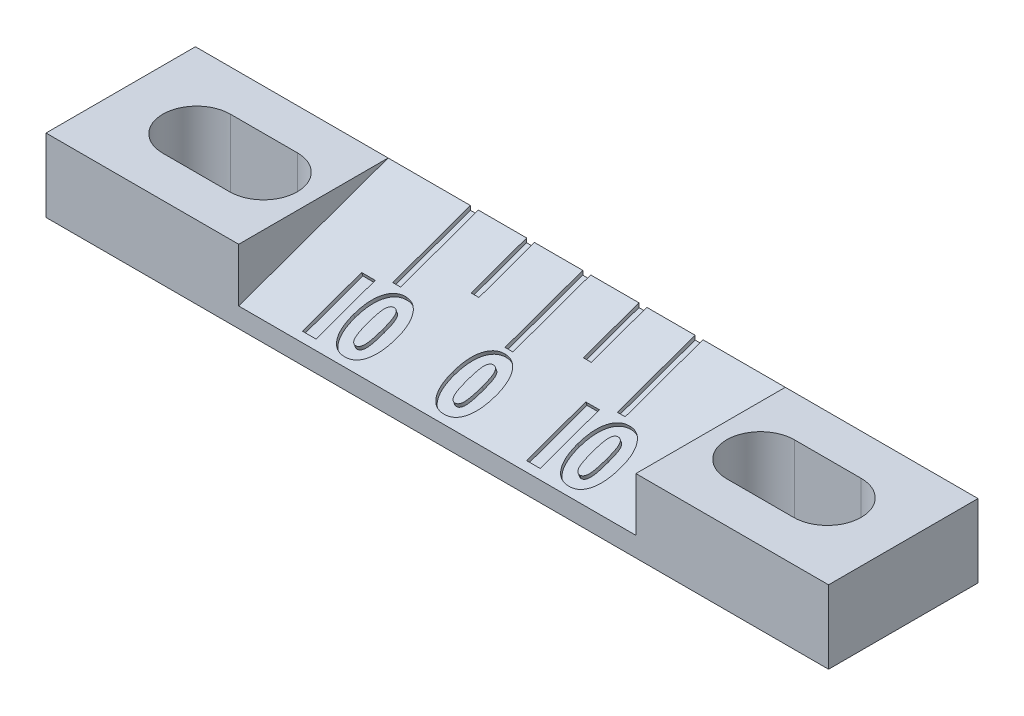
SolidWorks part; units mm, degrees
ref_plane "Спереди" through (0, 0, 0) normal (0, 0, 1) x (1, 0, 0)
ref_plane "Сверху" through (0, 0, 0) normal (0, 1, 0) x (1, 0, 0)
ref_plane "Справа" through (0, 0, 0) normal (1, 0, 0) x (0, 0, -1)
sketch "Эскиз1" plane through (0, 0, 0) normal (0, 1, 0) x (1, 0, 0)
  line L0 (2.4511, 0) -> (4.6101, 0) construction
  line L1 (0, 2.413) -> (25.273, 2.413)
  line L2 (0, 2.413) -> (0, -2.413)
  line L3 (0, -2.413) -> (25.273, -2.413)
  line L4 (25.273, 2.413) -> (25.273, -2.413)
  line L5 (2.4511, 1.0922) -> (4.6101, 1.0922)
  line L6 (2.4511, -1.0922) -> (4.6101, -1.0922)
  line L7 (20.6629, 0) -> (22.8219, 0) construction
  line L8 (20.6629, 1.0922) -> (22.8219, 1.0922)
  line L9 (20.6629, -1.0922) -> (22.8219, -1.0922)
  line L10 (12.6365, -4.7058) -> (12.6365, 8.8435) construction
  arc A0 (2.4511, 1.0922) -> (2.4511, -1.0922) centre (2.4511, 0) ccw
  arc A1 (4.6101, -1.0922) -> (4.6101, 1.0922) centre (4.6101, 0) ccw
  arc A2 (20.6629, 1.0922) -> (20.6629, -1.0922) centre (20.6629, 0) ccw
  arc A3 (22.8219, -1.0922) -> (22.8219, 1.0922) centre (22.8219, 0) ccw
  point P7 (3.5306, 0)
  point P12 (21.7424, 0)
  dimension "D1" = 25.273
  dimension "D2" = 2.413
  dimension "D3" = 2.1844
  dimension "D4" = 2.159
  dimension "D5" = 20.3708
  dimension "D6" = 10.1854
extrude "Бобышка-Вытянуть1" add sketch "Эскиз1" along normal blind 2.3622
sketch "Эскиз2" plane through (0, 0, 0) normal (-1, 0, 0) x (0, 0, 1)
  line L0 (-2.413, 2.3622) -> (2.413, 2.3622)
  line L1 (2.413, 2.3622) -> (2.413, 0.635)
  line L2 (2.413, 2.3622) -> (2.413, 0) construction
  line L3 (2.413, 0.635) -> (-2.413, 2.3622)
  line L4 (-2.413, 0) -> (2.413, 0) construction
  dimension "D1" = 0.635
extrude "Вырез-Вытянуть1" cut sketch "Эскиз2" against normal blind 12.827 from offset 6.223
sketch "Эскиз3" plane through (0, 1.3284, 0.4754) normal (0, 0.9415, 0.337) x (1, 0, 0)
  line L0 (8.0833, 0.4009) -> (18.9983, 0.4009) construction
  line L1 (7.557, 1.1629) -> (18.8705, 1.1629) construction
  line L2 (9.0094, -2.0579) -> (9.0094, 0.4009) construction
  line L3 (19.05, -2.0579) -> (6.223, -2.0579) construction
  line L4 (12.6365, -2.0579) -> (12.6365, 0.4009) construction
  line L5 (10.8229, 1.1629) -> (10.8229, -2.0579) construction
  line L6 (14.4501, 1.1629) -> (14.4501, -2.0579) construction
  line L7 (16.2636, 0.4009) -> (16.2636, -2.0579) construction
  line L9 (8.8824, 3.0679) -> (9.1364, 3.0679)
  line L10 (8.8824, 3.0679) -> (8.8824, 0.4009)
  line L11 (8.8824, 0.4009) -> (9.1364, 0.4009)
  line L12 (9.1364, 3.0679) -> (9.1364, 0.4009)
  line L13 (10.6959, 3.0679) -> (10.9499, 3.0679)
  line L14 (10.6959, 3.0679) -> (10.6959, 1.1629)
  line L15 (10.6959, 1.1629) -> (10.9499, 1.1629)
  line L16 (10.9499, 3.0679) -> (10.9499, 1.1629)
  line L17 (12.5095, 3.0679) -> (12.7635, 3.0679)
  line L18 (12.5095, 3.0679) -> (12.5095, 0.4009)
  line L19 (12.5095, 0.4009) -> (12.7635, 0.4009)
  line L20 (12.7635, 3.0679) -> (12.7635, 0.4009)
  line L21 (14.5771, 1.1629) -> (14.3231, 1.1629)
  line L22 (14.5771, 1.1629) -> (14.5771, 3.0679)
  line L23 (14.5771, 3.0679) -> (14.3231, 3.0679)
  line L24 (14.3231, 1.1629) -> (14.3231, 3.0679)
  line L25 (16.3906, 0.4009) -> (16.1366, 0.4009)
  line L26 (16.3906, 0.4009) -> (16.3906, 3.0679)
  line L27 (16.3906, 3.0679) -> (16.1366, 3.0679)
  line L28 (16.1366, 0.4009) -> (16.1366, 3.0679)
  line L29 (7.4369, -1.8039) -> (18.5447, -1.8039) construction
  line L30 (19.05, 3.0679) -> (6.223, 3.0679) construction
  text T0 "10      0     10  " font "Gill Sans MT" height 2.032
  dimension "D1" = 3.6271
  dimension "D2" = 3.6271
  dimension "D3" = 1.8136
  dimension "D4" = 1.8136
  dimension "D5" = 2.667
  dimension "D6" = 1.905
  dimension "D7" = 0.254
  dimension "D8" = 0.254
extrude "Вырез-Вытянуть2" cut sketch "Эскиз3" against normal blind 0.127
equation "\"D2@Эскиз3\"=\"D1@Эскиз3\""
equation "\"D3@Эскиз3\"=\"D1@Эскиз3\"/2"
equation "\"D4@Эскиз3\"=\"D1@Эскиз3\"/2"
